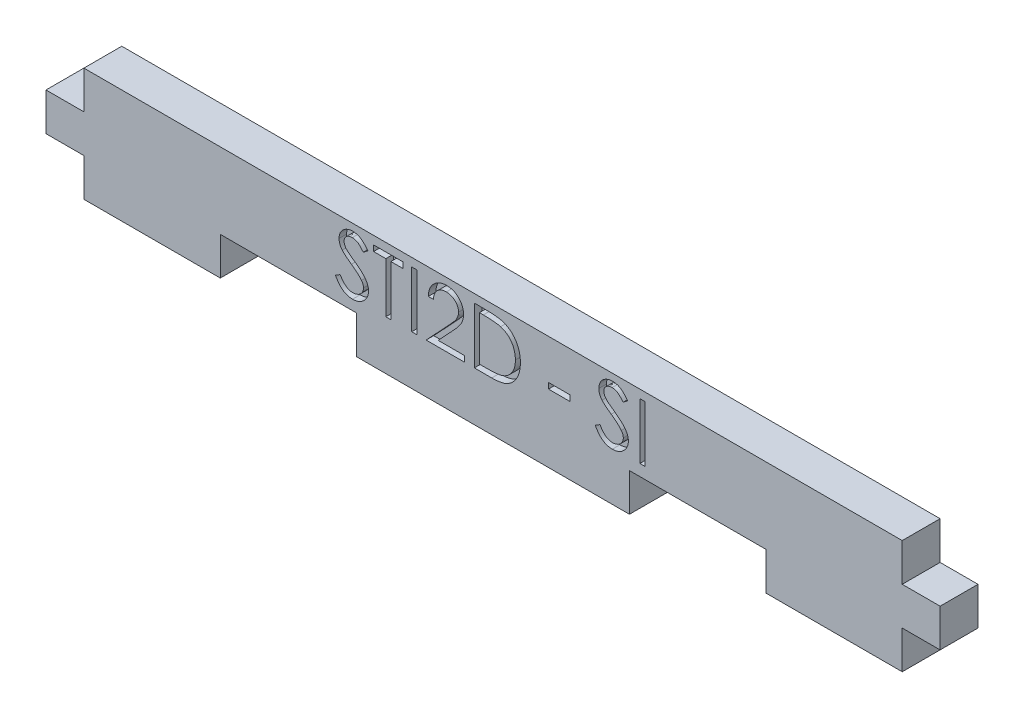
SolidWorks part; units mm, degrees
ref_plane "Plan de face" through (0, 0, 0) normal (0, 0, 1) x (1, 0, 0)
ref_plane "Plan de dessus" through (0, 0, 0) normal (0, 1, 0) x (1, 0, 0)
ref_plane "Plan de droite" through (0, 0, 0) normal (1, 0, 0) x (0, 0, -1)
sketch "Esquisse1" plane through (0, 0, 0) normal (0, 0, 1) x (1, 0, 0)
  line L1 (-59, 7.5) -> (59, 7.5)
  line L2 (-59, 7.5) -> (-59, -7.5)
  line L3 (-59, -7.5) -> (59, -7.5)
  line L4 (59, 7.5) -> (59, -7.5)
  line L5 (-59, 7.5) -> (59, -7.5) construction
  line L6 (-59, -7.5) -> (59, 7.5) construction
  point P0 (0, 0)
  dimension "D1" = 15
  dimension "D2" = 118
extrude "Boss.-Extru.1" add sketch "Esquisse1" along normal blind 5
sketch "Esquisse2" plane through (0, 0, 5) normal (0, 0, 1) x (1, 0, 0)
  line L0 (-59, 7.5) -> (-59, 2.5) construction
  line L1 (-59, 2.5) -> (-59, -2.5) construction
  line L2 (-59, -2.5) -> (-59, -7.5) construction
  line L3 (-59, 7.5) -> (-59, -7.5) construction
  line L4 (59, 7.5) -> (-59, 7.5) construction
  line L5 (-59, 2.5) -> (-54, 2.5)
  line L6 (-59, 2.5) -> (-59, 7.5)
  line L7 (-59, 7.5) -> (-54, 7.5)
  line L8 (-54, 2.5) -> (-54, 7.5)
  line L9 (-59, -7.5) -> (59, -7.5) construction
  line L10 (-59, -2.5) -> (-54, -2.5)
  line L11 (-59, -2.5) -> (-59, -7.5)
  line L12 (-59, -7.5) -> (-54, -7.5)
  line L13 (-54, -2.5) -> (-54, -7.5)
  line L14 (-54, -7.5) -> (-36, -7.5) construction
  line L15 (-36, -7.5) -> (-18, -7.5) construction
  line L16 (-18, -7.5) -> (0, -7.5) construction
  line L18 (-36, -7.5) -> (-18, -7.5)
  line L19 (-36, -7.5) -> (-36, -2.5)
  line L20 (-36, -2.5) -> (-18, -2.5)
  line L21 (-18, -7.5) -> (-18, -2.5)
  dimension "D1" = 5
extrude "Enlèv. mat.-Extru.1" cut sketch "Esquisse2" against normal through all both and the other way through all
ref_plane "Plan1" through (0, 0, 0) normal (-1, 0, 0) x (0, 0, 1)
mirror "Symétrie1" about plane through (0, 0, 0) normal (-1, 0, 0) of "Enlèv. mat.-Extru.1"
sketch "Esquisse5" plane through (0, 0, 5) normal (0, 0, 1) x (1, 0, 0)
  line L0 (-54, -1) -> (54, -1) construction
  line L1 (-54, -2.5) -> (-59, -2.5) construction
  text T0 "STI2D - SI" font "Century Gothic" height in points 28
  dimension "D1" = 1.5
extrude "Enlèv. mat.-Extru.4" cut sketch "Esquisse5" against normal blind 1
